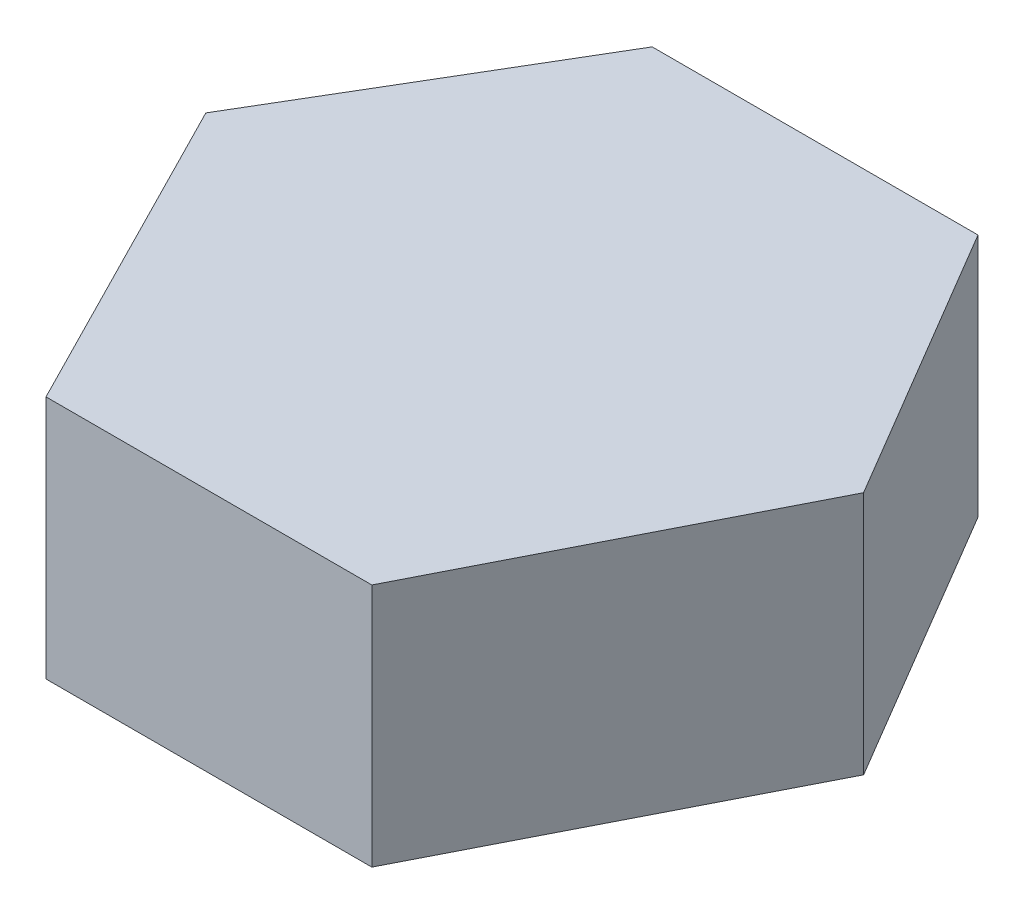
SolidWorks part; units mm, degrees
ref_plane "前视基准面" through (0, 0, 0) normal (0, 0, 1) x (1, 0, 0)
ref_plane "上视基准面" through (0, 0, 0) normal (0, 1, 0) x (1, 0, 0)
ref_plane "右视基准面" through (0, 0, 0) normal (1, 0, 0) x (0, 0, -1)
sketch "草图1" plane through (0, 0, 0) normal (0, 1, 0) x (1, 0, 0)
  line L0 (-65.9279, 0) -> (46.5044, 0) construction
  line L1 (-17.3333, 88.1206) -> (-17.3333, -63.1588) construction
  line L2 (2.6667, 34.4206) -> (-37.3333, 34.4206)
  line L3 (-37.3333, 34.4206) -> (-57.7103, 0)
  line L4 (-57.7103, 0) -> (-37.3333, -40)
  line L5 (-37.3333, -40) -> (2.6667, -40)
  line L6 (23.0437, 0) -> (2.6667, -40)
  line L7 (2.6667, 34.4206) -> (23.0437, 0)
  point P11 (-17.3333, -40)
  point P13 (-17.3333, 34.4206)
  dimension "D1" = 40
  dimension "D2" = 40
  dimension "D3" = 20
  dimension "D4" = 20
extrude "拉伸1" add sketch "草图1" along normal blind 30
